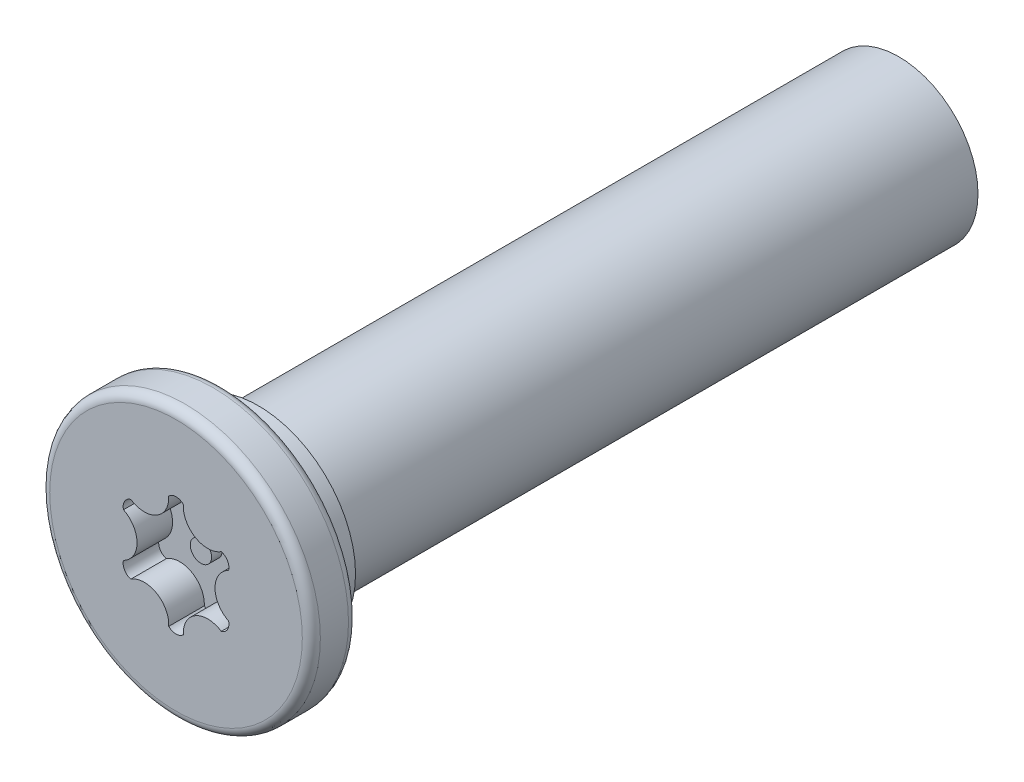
SolidWorks part; units mm, degrees
ref_plane "Front Plane" through (0, 0, 0) normal (0, 0, 1) x (1, 0, 0)
ref_plane "Top Plane" through (0, 0, 0) normal (0, 1, 0) x (1, 0, 0)
ref_plane "Right Plane" through (0, 0, 0) normal (1, 0, 0) x (0, 0, -1)
sketch "Sketch2" plane through (0, 0, 0) normal (1, 0, 0) x (0, 0, -1)
  line L1 (0, 0) -> (1.3, 0)
  line L2 (0, 0) -> (0, 3.81)
  line L3 (0, 3.81) -> (1.3, 3.81)
  line L4 (1.3, 0) -> (1.3, 3.81)
  line L5 (1.3, 0) -> (14, 0)
  line L6 (1.3, 0) -> (1.3, 2.23)
  line L7 (1.3, 2.23) -> (14, 2.23)
  line L8 (14, 0) -> (14, 2.23)
  dimension "D1" = 3.81
  dimension "D2" = 1.3
  dimension "D3" = 12.7
  dimension "D4" = 2.23
revolve "Revolve1" add sketch "Sketch2" angle 360 about L5
sketch "Sketch3" plane through (0, 0, 0) normal (0, 0, 1) x (1, 0, 0)
  line L0 (0, 1.3843) -> (0, 0)
  line L3 (1.1845, -1.0048) -> (2.4257, -1.0048)
  line L4 (0, 1.675) -> (0, 1.6727)
  line L5 (0, 1.675) -> (0, 1.6727)
  line L6 (0, 1.6727) -> (0, 1.675)
  line L8 (1.0407, 1.8026) -> (1.1012, 1.9073)
  line L9 (1.3857, 1.205) -> (2.5818, 1.205)
  line L10 (0, 0) -> (0.8375, 1.4506)
  line L11 (0, 0) -> (2.5818, 0)
  line L14 (2.5818, 0) -> (2.5818, 1.205)
  line L15 (1.3857, 1.205) -> (-0.1691, 1.205)
  circle A0 centre (0, 0) radius 1.675
  arc A7 (1.1845, -1.0048) -> (1.0345, -1.0748) centre (0.8546, -0.4934) cw
  arc A16 (-0.2051, 1.5894) -> (0.2051, 1.5894) centre (0, 1.3843) cw
  arc A18 (0.2051, 1.5894) -> (1.2739, 0.9723) centre (0.8938, 1.5482) ccw
  arc A19 (1.479, 0.6171) -> (1.479, -0.6171) centre (1.7877, 0) ccw
  arc A20 (1.2739, 0.9723) -> (1.479, 0.6171) centre (1.1988, 0.6922) cw
  arc A21 (1.2739, -0.9723) -> (0.2051, -1.5894) centre (0.8938, -1.5482) ccw
  arc A22 (1.479, -0.6171) -> (1.2739, -0.9723) centre (1.1988, -0.6922) cw
  arc A23 (-0.2051, -1.5894) -> (-1.2739, -0.9723) centre (-0.8938, -1.5482) ccw
  arc A24 (0.2051, -1.5894) -> (-0.2051, -1.5894) centre (0, -1.3843) cw
  arc A25 (-1.479, -0.6171) -> (-1.479, 0.6171) centre (-1.7877, 0) ccw
  arc A26 (-1.2739, -0.9723) -> (-1.479, -0.6171) centre (-1.1988, -0.6922) cw
  arc A27 (-1.2739, 0.9723) -> (-0.2051, 1.5894) centre (-0.8938, 1.5482) ccw
  arc A28 (-1.479, 0.6171) -> (-1.2739, 0.9723) centre (-1.1988, 0.6922) cw
  point P38 (0, 0)
  point P52 (0, 0)
  dimension "D1" = 3.35
  dimension "D4" = 1.205
  dimension "D2" = 6
  dimension "D5" = 60
extrude "Cut-Extrude3" cut sketch "Sketch3" against normal blind 1
fillet "Fillet12" radius 0.254 2 edges at (3.81, 0, 0) (3.81, 0, -1.3)
sketch "Sketch7" plane through (0, 0, -14) normal (0, 0, -1) x (-1, 0, 0)
  circle A0 centre (0, 0) radius 2.23
  dimension "D1" = 4.46
extrude "Cut-Extrude6" cut sketch "Sketch7" against normal blind 12.7
sketch "Sketch11" plane through (0, 0, -1.3) normal (0, 0, -1) x (-1, 0, 0)
  circle A0 centre (0, 0) radius 2.23
  circle A1 centre (0, 0) radius 2.738
extrude "Boss-Extrude1" add sketch "Sketch11" along normal blind 1.016
sketch "Sketch12" plane through (0, 0, -1.3) normal (0, 0, -1) x (-1, 0, 0)
  circle A0 centre (0, 0) radius 2.23
extrude "Boss-Extrude2" add sketch "Sketch12" along normal blind 12.7
sketch "Sketch14" plane through (0, 0, -1) normal (0, 0, 1) x (1, 0, 0)
  circle A0 centre (0, 0) radius 0.3
extrude "Boss-Extrude4" add sketch "Sketch14" along normal blind 0.3
sketch "Sketch15" plane through (0, 0, -14) normal (0, 0, -1) x (-1, 0, 0)
  circle A0 centre (0, 0) radius 2.23
extrude "Cut-Extrude7" cut sketch "Sketch15" against normal blind 12.7
sketch "Sketch16" plane through (0, 0, -1.3) normal (0, 0, -1) x (-1, 0, 0)
  circle A0 centre (0, 0) radius 2.23
extrude "Boss-Extrude5" add sketch "Sketch16" along normal blind 19.05
